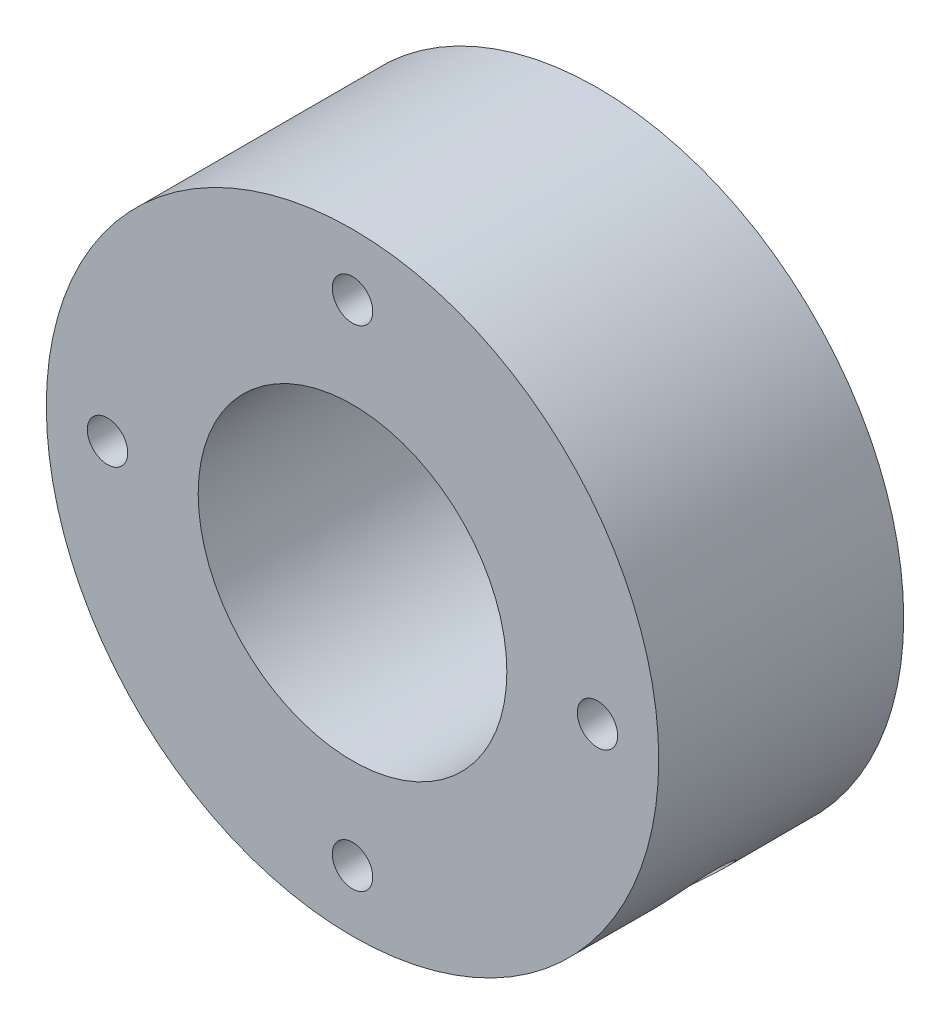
SolidWorks part; units mm, degrees
ref_plane "前视基准面" through (0, 0, 0) normal (0, 0, 1) x (1, 0, 0)
ref_plane "上视基准面" through (0, 0, 0) normal (0, 1, 0) x (1, 0, 0)
ref_plane "右视基准面" through (0, 0, 0) normal (1, 0, 0) x (0, 0, -1)
sketch "草图1" plane through (0, 0, 0) normal (0, 0, 1) x (1, 0, 0)
  circle A0 centre (0, 0) radius 25
  circle A1 centre (0, 0) radius 12.6
extrude "凸台-拉伸1" add sketch "草图1" along normal blind 20
sketch "草图2" plane through (0, 0, 20) normal (0, 0, 1) x (1, 0, 0)
  circle A0 centre (0, 20) radius 1.65
  circle A1 centre (20, 0) radius 1.65
  circle A2 centre (0, -20) radius 1.65
  circle A3 centre (-20, 0) radius 1.65
extrude "切除-拉伸1" cut sketch "草图2" against normal blind 15
ref_plane "基准面3" through (17.6777, -17.6777, 0) normal (0.7071, -0.7071, 0) x (0, 0, -1)
sketch "草图4" plane through (17.6777, -17.6777, 0) normal (0.7071, -0.7071, 0) x (0, 0, -1)
  circle A0 centre (-10, 0) radius 3
extrude "切除-拉伸2" cut sketch "草图4" against normal blind 15
